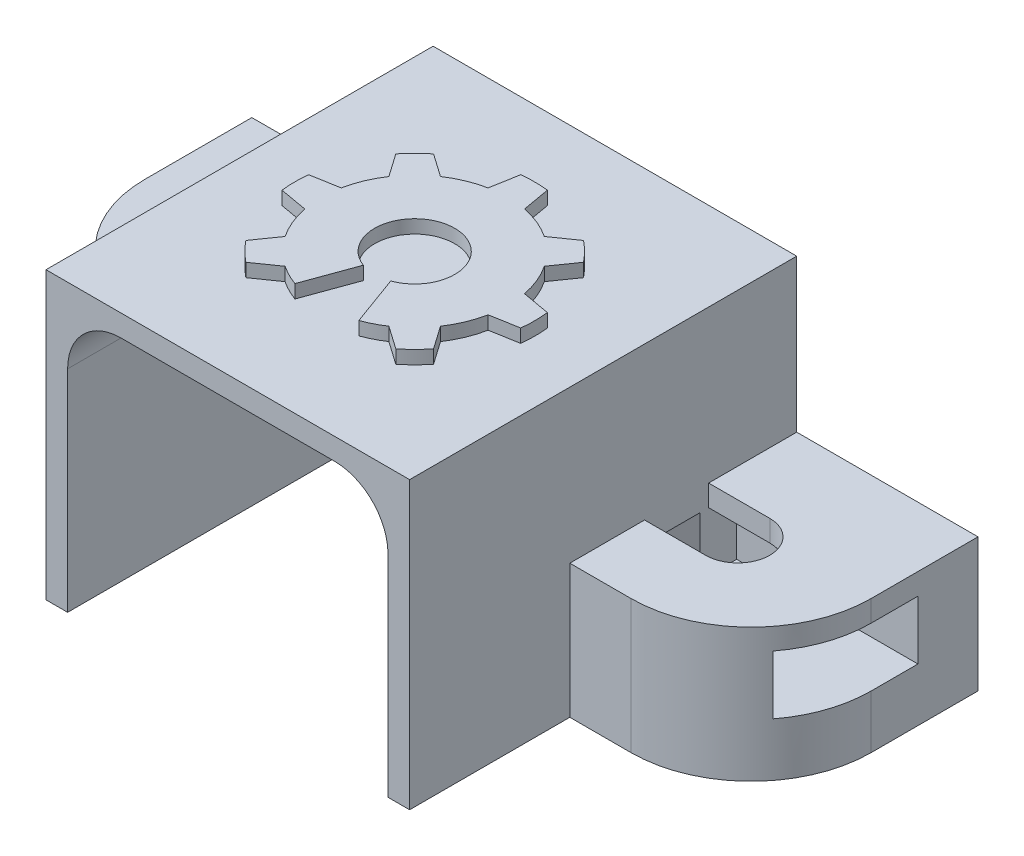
SolidWorks part; units mm, degrees
ref_plane "Front Plane" through (0, 0, 0) normal (0, 0, 1) x (1, 0, 0)
ref_plane "Top Plane" through (0, 0, 0) normal (0, 1, 0) x (1, 0, 0)
ref_plane "Right Plane" through (0, 0, 0) normal (1, 0, 0) x (0, 0, -1)
sketch "Sketch1" plane through (0, 0, 0) normal (0, 0, 1) x (1, 0, 0)
  line L0 (6, 0) -> (6, 9.9)
  line L1 (6, 9.9) -> (-6, 9.9)
  line L2 (0, 10.71) -> (0, 9.9) construction
  line L3 (-6.81, 10.71) -> (6.81, 10.71)
  line L4 (6.81, 10.71) -> (6.81, 0)
  line L5 (6.81, 0) -> (6, 0)
  line L6 (-6.81, 0) -> (-6, 0)
  line L7 (-6.81, 10.71) -> (-6.81, 0)
  line L8 (-6, 0) -> (-6, 9.9)
  dimension "D1" = 6
  dimension "D2" = 9.9
  dimension "D3" = 0.81
  dimension "D4" = 0.81
extrude "Boss-Extrude1" add sketch "Sketch1" along normal blind 5
fillet "Fillet2" radius 2 2 edges at (6, 9.9, 2.5) (-6, 9.9, 2.5)
sketch "Sketch3" plane through (0, 0, 0) normal (0, 0, -1) x (-1, 0, 0)
  line L0 (6, 0) -> (6, 9.75)
  line L1 (6, 9.75) -> (-6, 9.75)
  line L2 (-6.81, 10.71) -> (6.81, 10.71)
  line L3 (-6.81, 10.71) -> (6.81, 10.71) construction
  line L4 (6.81, 10.71) -> (6.81, 0)
  line L5 (6.81, 0) -> (6, 0)
  line L6 (0, 0) -> (0, 8.4964) construction
  line L7 (-5, 0) -> (5, 0) construction
  line L8 (-6.81, 0) -> (-6, 0)
  line L9 (-6.81, 10.71) -> (-6.81, 0)
  line L10 (-6, 0) -> (-6, 9.75)
  point P19 (0, 10.71)
  point P20 (0, 9.75)
  dimension "D1" = 9.75
extrude "Boss-Extrude3" add sketch "Sketch3" along normal blind 9.5
sketch "Sketch2" plane through (0, 0, 0) normal (0, 1, 0) x (1, 0, 0)
  line L0 (6.81, 9.5) -> (6.81, 6.2)
  line L1 (6.81, -5) -> (6.81, 9.5) construction
  line L2 (6.81, 1) -> (9.1, 1)
  line L3 (6.81, 9.5) -> (13.6, 9.5)
  line L4 (6.81, 6.2) -> (9.1, 6.2)
  line L5 (6.81, 3.8) -> (6.81, 1)
  line L6 (6.81, 3.8) -> (9.1, 3.8)
  line L7 (0, 0) -> (0, 14.4054) construction
  line L8 (-13.6, 9.5) -> (-13.6, 5.5)
  line L9 (-6.81, 9.5) -> (6.81, 9.5) construction
  line L10 (-6.81, 3.8) -> (-6.81, 1)
  line L11 (-6.81, 3.8) -> (-9.1, 3.8)
  line L12 (-6.81, 9.5) -> (-13.6, 9.5)
  line L13 (-6.81, 1) -> (-9.1, 1)
  line L14 (6.81, -5) -> (6.81, 9.5) construction
  line L15 (6.81, -5) -> (6.81, 9.5) construction
  line L16 (13.6, 9.5) -> (13.6, 5.5)
  line L17 (-6.81, 9.5) -> (-6.81, 6.2)
  line L18 (-6.81, 6.2) -> (-9.1, 6.2)
  arc A0 (13.6, 5.5) -> (9.1, 1) centre (9.1, 5.5) cw
  arc A1 (9.1, 6.2) -> (9.1, 3.8) centre (9.1, 5) cw
  arc A2 (-9.1, 6.2) -> (-9.1, 3.8) centre (-9.1, 5) ccw
  arc A3 (-13.6, 5.5) -> (-9.1, 1) centre (-9.1, 5.5) ccw
  dimension "D3" = 1.2
  dimension "D1" = 4.5
  dimension "D2" = 9.1
  dimension "D4" = 1
  dimension "D5" = 4.5
extrude "Boss-Extrude2" add sketch "Sketch2" along normal blind 5
fillet "Fillet1" [suppressed] radius 2
sketch "Sketch4" plane through (0, 0, 0) normal (0, 1, 0) x (1, 0, 0)
  line L0 (9.1, 5) -> (8.9, 5) construction
  line L1 (10.199, 7.25) -> (7.601, 7.25)
  line L2 (7.601, 7.25) -> (6.3019, 5)
  line L3 (6.3019, 5) -> (7.601, 2.75)
  line L4 (7.601, 2.75) -> (10.199, 2.75)
  line L5 (10.199, 2.75) -> (11.4981, 5)
  line L6 (11.4981, 5) -> (10.199, 7.25)
  circle A0 centre (8.9, 5) radius 2.25 construction
  arc A1 (9.1, 3.8) -> (9.1, 6.2) centre (9.1, 5) ccw construction
  dimension "D1" = 4.5
  dimension "D2" = 0.2
extrude "Cut-Extrude1" cut sketch "Sketch4" along normal blind 2.2 from offset 2
mirror "Mirror2" about plane through (0, 0, 0) normal (1, 0, 0) of "Cut-Extrude1"
mirror "Mirror1" [suppressed] about plane through (0, 0, 0) normal (1, 0, 0)
sketch "Sketch5" plane through (0, 0, -9.5) normal (0, 0, -1) x (-1, 0, 0)
  line L0 (-7, 0) -> (-7, -0.06)
  line L1 (-6.25, -0.81) -> (6.25, -0.81)
  line L2 (7, -0.06) -> (7, 0)
  line L3 (-6, 0) -> (-6, -0.45)
  line L4 (-6, -0.45) -> (0, -0.45)
  line L5 (0, -0.45) -> (6, -0.45)
  line L6 (6, -0.45) -> (6, 0)
  line L8 (6, 0) -> (7, 0)
  line L9 (-6, 0) -> (-7, 0)
  line L10 (-6, 9.75) -> (-4.7599, 9.75) construction
  arc A0 (6.25, -0.81) -> (7, -0.06) centre (6.25, -0.06) ccw
  arc A1 (-7, -0.06) -> (-6.25, -0.81) centre (-6.25, -0.06) ccw
  point P2 (-6, 0)
  point P6 (6, 0)
  dimension "D2" = 0.75
  dimension "D1" = 10.2
  dimension "D3" = 14
  dimension "D4" = 7
extrude "Boss-Extrude4" [suppressed] add sketch "Sketch5" against normal blind 2.5
chamfer "Chamfer1" [suppressed] distance 1 angle 45
sketch "Sketch6" plane through (0, 10.71, 0) normal (0, 1, 0) x (1, 0, 0)
  line L0 (0.513, 0.5905) -> (1.1971, -1.2889)
  line L1 (-0.513, 0.5905) -> (-1.1971, -1.2889)
  line L2 (0, 0) -> (0, 2) construction
  line L3 (1.9441, -0.9104) -> (2.8087, -1.5158)
  line L4 (2.9104, 0.0559) -> (3.5158, -0.8087)
  line L5 (0, 2) -> (3.182, -1.182) construction
  line L6 (0.6833, -1.4327) -> (0.5, -2.4721)
  line L7 (-0.6833, -1.4327) -> (-0.5, -2.4721)
  line L8 (-1.9441, -0.9104) -> (-2.8087, -1.5158)
  line L9 (-2.9104, 0.0559) -> (-3.5158, -0.8087)
  line L10 (-3.4327, 1.3167) -> (-4.4721, 1.5)
  line L11 (-3.4327, 2.6833) -> (-4.4721, 2.5)
  line L12 (-2.9104, 3.9441) -> (-3.5158, 4.8087)
  line L13 (-1.9441, 4.9104) -> (-2.8087, 5.5158)
  line L14 (-0.6833, 5.4327) -> (-0.5, 6.4721)
  line L15 (0.6833, 5.4327) -> (0.5, 6.4721)
  line L16 (1.9441, 4.9104) -> (2.8087, 5.5158)
  line L17 (2.9104, 3.9441) -> (3.5158, 4.8087)
  line L18 (3.4327, 2.6833) -> (4.4721, 2.5)
  line L19 (3.4327, 1.3167) -> (4.4721, 1.5)
  arc A0 (0.513, 0.5905) -> (-0.513, 0.5905) centre (0, 2) ccw
  arc A1 (3.5158, -0.8087) -> (2.8087, -1.5158) centre (0, 2) cw
  arc A2 (-1.1971, -1.2889) -> (-1.9441, -0.9104) centre (0, 2) cw
  arc A3 (0.5, -2.4721) -> (-0.5, -2.4721) centre (0, 2) cw
  arc A4 (-2.8087, -1.5158) -> (-3.5158, -0.8087) centre (0, 2) cw
  arc A5 (-4.4721, 1.5) -> (-4.4721, 2.5) centre (0, 2) cw
  arc A6 (-3.5158, 4.8087) -> (-2.8087, 5.5158) centre (0, 2) cw
  arc A7 (-0.5, 6.4721) -> (0.5, 6.4721) centre (0, 2) cw
  arc A8 (2.8087, 5.5158) -> (3.5158, 4.8087) centre (0, 2) cw
  arc A9 (4.4721, 2.5) -> (4.4721, 1.5) centre (0, 2) cw
  arc A10 (-2.9104, 0.0559) -> (-3.4327, 1.3167) centre (0, 2) cw
  arc A11 (-3.4327, 2.6833) -> (-2.9104, 3.9441) centre (0, 2) cw
  arc A12 (-1.9441, 4.9104) -> (-0.6833, 5.4327) centre (0, 2) cw
  arc A13 (0.6833, 5.4327) -> (1.9441, 4.9104) centre (0, 2) cw
  arc A14 (2.9104, 3.9441) -> (3.4327, 2.6833) centre (0, 2) cw
  arc A15 (3.4327, 1.3167) -> (2.9104, 0.0559) centre (0, 2) cw
  arc A16 (1.9441, -0.9104) -> (1.1971, -1.2889) centre (0, 2) cw
  point P44 (0, 2)
  dimension "D1" = 1.5
  dimension "D2" = 3.5
  dimension "D3" = 4.5
  dimension "D7" = 1
  dimension "D4" = 20
  dimension "D5" = 20
  dimension "D6" = 10
  dimension "D8" = 45
  dimension "D10" = 2
  dimension "D9" = 8
extrude "Boss-Extrude5" add sketch "Sketch6" along normal blind 0.5
sketch "Sketch7" plane through (13.6, 0, 0) normal (1, 0, 0) x (0, 0, -1)
  line L0 (5.5, 0) -> (9.5, 0) construction
  line L1 (2.75, 4.2) -> (7.25, 4.2)
  line L2 (2.75, 4.2) -> (2.75, 2)
  line L3 (2.75, 2) -> (7.25, 2)
  line L4 (7.25, 4.2) -> (7.25, 2)
  line L5 (3.8, 1.9716) -> (6.2, 1.9716) construction
  line L7 (3.8, 2) -> (3.8, 4.2) construction
  line L8 (6.2, 1.9716) -> (5, 1.9716) construction
  line L9 (5, 1.9716) -> (5, 4.2) construction
  line L10 (6.2, 4.2) -> (6.2, 2) construction
  dimension "D1" = 4.5
  dimension "D2" = 2.2
  dimension "D3" = 2
extrude "Cut-Extrude3" cut sketch "Sketch7" against normal up to surface (6.79 mm away)
sketch "Sketch8" plane through (-13.6, 0, 0) normal (-1, 0, 0) x (0, 0, 1)
  line L4 (-2.75, 4.2) -> (-7.25, 4.2)
  line L5 (-7.25, 4.2) -> (-7.25, 2)
  line L6 (-7.25, 2) -> (-2.75, 2)
  line L7 (-2.75, 2) -> (-2.75, 4.2)
  line L8 (-2.75, 4.2) -> (-7.25, 4.2)
  line L9 (-7.25, 4.2) -> (-7.25, 2)
  line L10 (-7.25, 2) -> (-2.75, 2)
  line L11 (-2.75, 2) -> (-2.75, 4.2)
  dimension "D1" = 0
extrude "Cut-Extrude4" cut sketch "Sketch8" against normal up to surface (6.79 mm away)
